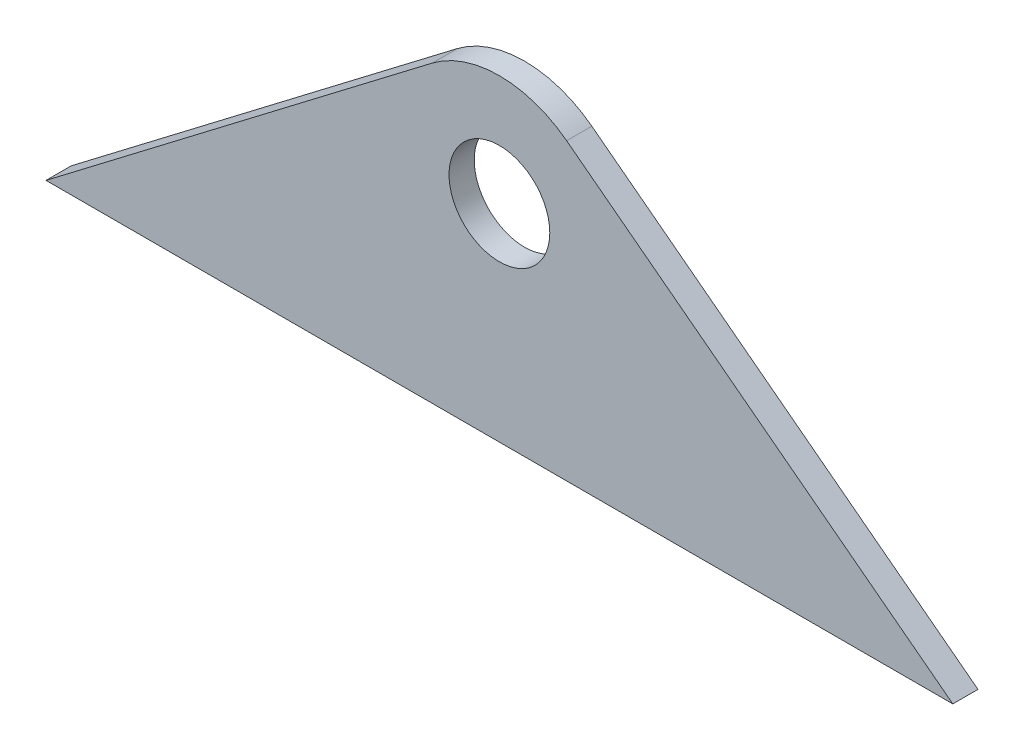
SolidWorks part; units mm, degrees
ref_plane "Plan de face" through (0, 0, 0) normal (0, 0, 1) x (1, 0, 0)
ref_plane "Plan de dessus" through (0, 0, 0) normal (0, 1, 0) x (1, 0, 0)
ref_plane "Plan de droite" through (0, 0, 0) normal (1, 0, 0) x (0, 0, -1)
sketch "Esquisse1" plane through (0, 0, 0) normal (0, 0, 1) x (1, 0, 0)
  line L0 (-90, -41) -> (90, -41)
  line L1 (90, -41) -> (13.3454, 17.49)
  line L2 (-13.3454, 17.49) -> (-90, -41)
  line L3 (0, 0) -> (0, -41) construction
  circle A0 centre (0, 0) radius 10
  arc A1 (13.3454, 17.49) -> (-13.3454, 17.49) centre (0, 0) ccw
  dimension "D3" = 22
  dimension "D4" = 20
  dimension "D1" = 41
  dimension "D2" = 180
extrude "Extrusion1" add sketch "Esquisse1" along normal blind 5
